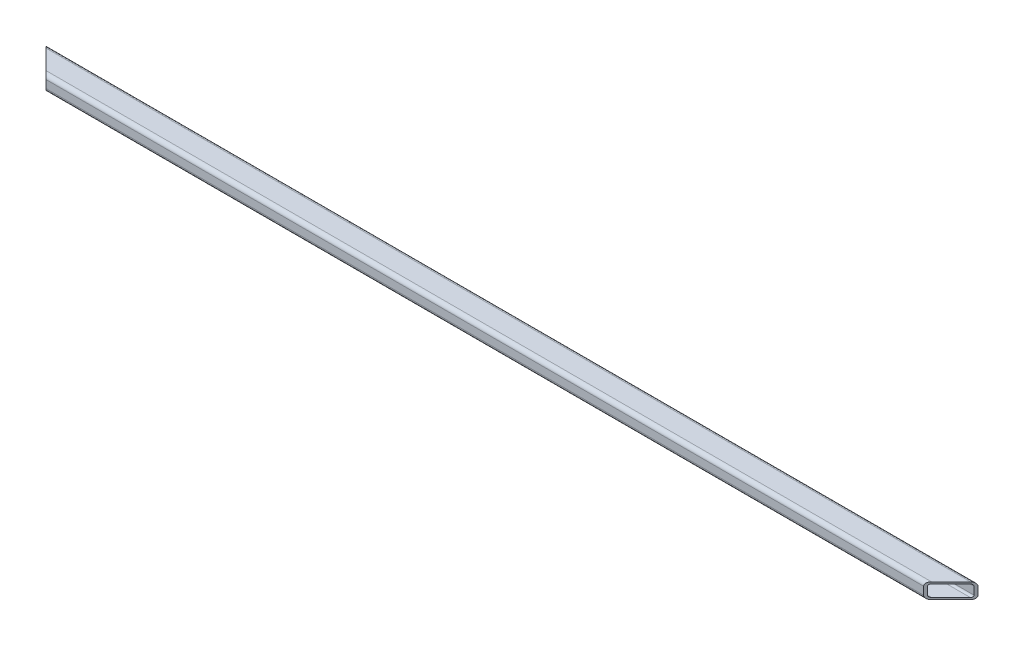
SolidWorks part; units mm, degrees
ref_plane "Plan1" through (0, 0, 0) normal (0, 0, 1) x (1, 0, 0)
ref_plane "Plan2" through (0, 0, 0) normal (0, 1, 0) x (1, 0, 0)
ref_plane "Plan3" through (0, 0, 0) normal (1, 0, 0) x (0, 0, -1)
sketch "Esquisse1" plane through (0, 0, 0) normal (1, 0, 0) x (0, 0, -1)
  line L0 (-17.5, 0) -> (17.5, 0) construction
  line L1 (-12.5, 10) -> (12.5, 10)
  line L2 (-17.5, 5) -> (-17.5, -5)
  line L3 (-12.5, -10) -> (12.5, -10)
  line L4 (17.5, 5) -> (17.5, -5)
  line L5 (0, -10) -> (0, 10) construction
  line L6 (-12.5, 7.5) -> (12.5, 7.5)
  line L7 (15, 5) -> (15, -5)
  line L8 (-12.5, -7.5) -> (12.5, -7.5)
  line L9 (-15, 5) -> (-15, -5)
  arc A0 (17.5, 5) -> (12.5, 10) centre (12.5, 5) ccw
  arc A1 (-17.5, 5) -> (-12.5, 10) centre (-12.5, 5) cw
  arc A2 (-12.5, -10) -> (-17.5, -5) centre (-12.5, -5) cw
  arc A3 (17.5, -5) -> (12.5, -10) centre (12.5, -5) cw
  arc A4 (-15, 5) -> (-12.5, 7.5) centre (-12.5, 5) cw
  arc A5 (15, 5) -> (12.5, 7.5) centre (12.5, 5) ccw
  arc A6 (15, -5) -> (12.5, -7.5) centre (12.5, -5) cw
  arc A7 (-12.5, -7.5) -> (-15, -5) centre (-12.5, -5) cw
  dimension "e" = 2.5
  dimension "C" = 20
  dimension "B" = 35
extrude "Base-Extrusion" add sketch "Esquisse1" along normal blind 1200
sketch "Esquisse2" plane through (0, 10, 0) normal (0, 1, 0) x (-1, 0, 0)
  line L0 (-1200, 17.5) -> (-1200, -17.5)
  line L1 (-1200, -17.5) -> (-1165, 17.5)
  line L2 (-1200, 17.5) -> (0, 17.5) construction
  line L3 (-1165, 17.5) -> (-1200, 17.5)
  dimension "D1" = 35
  dimension "D2" = 35
extrude "Enlèv. mat.-Extru.1" cut sketch "Esquisse2" against normal through all
sketch "Esquisse3" plane through (0, 10, 0) normal (0, 1, 0) x (-1, 0, 0)
  line L0 (0, -17.5) -> (-35, 17.5)
  line L3 (-1165, 17.5) -> (0, 17.5) construction
  line L4 (0, -12.5) -> (0, 12.5) construction
  line L5 (0, -17.5) -> (0, 17.5)
  line L6 (0, 17.5) -> (-35, 17.5)
  dimension "D1" = 35
extrude "Enlèv. mat.-Extru.3" cut sketch "Esquisse3" against normal through all
